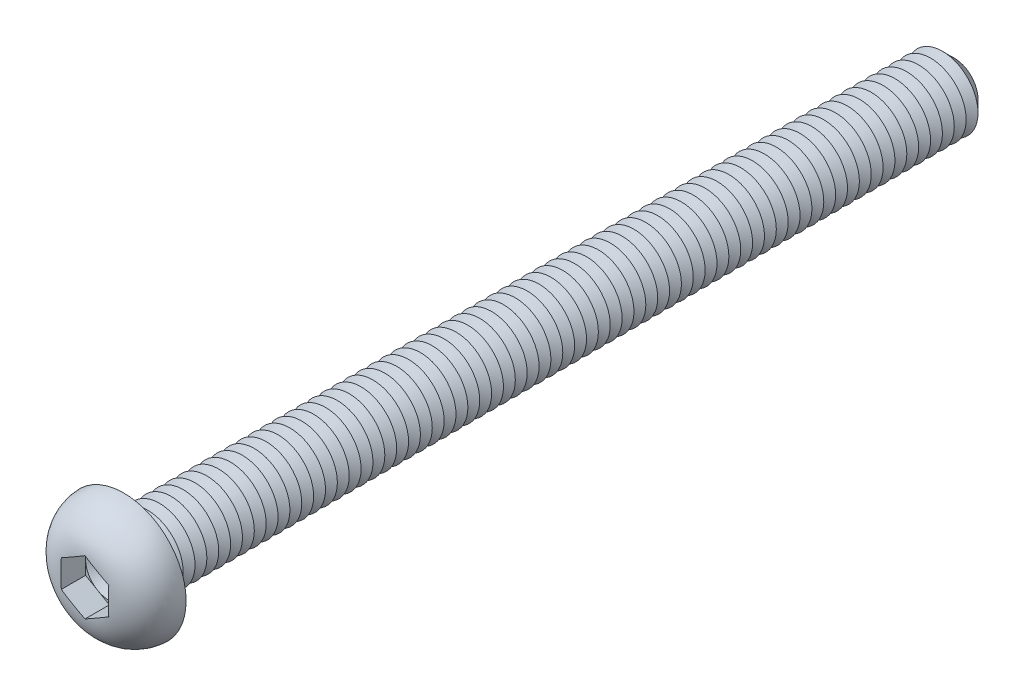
SolidWorks part; units mm, degrees
ref_plane "Front Plane" through (0, 0, 0) normal (0, 0, 1) x (1, 0, 0)
ref_plane "Top Plane" through (0, 0, 0) normal (0, 1, 0) x (1, 0, 0)
ref_plane "Right Plane" through (0, 0, 0) normal (1, 0, 0) x (0, 0, -1)
sketch "Sketch1" plane through (0, 0, 0) normal (1, 0, 0) x (0, 0, -1)
  line L0 (-47.9342, 0) -> (60.3146, 0) construction
sketch "Sketch2" plane through (0, 0, 0) normal (1, 0, 0) x (0, 0, -1)
  line L0 (0, 0) -> (-3.3, 0)
  line L1 (-47.9342, 0) -> (60.3146, 0) construction
  line L2 (-3.3, 0) -> (-3.3, 1.8515)
  line L3 (0, 5.25) -> (0, 0)
  arc A0 (-3.3, 1.8515) -> (0, 5.25) centre (0.1, 1.8515) cw
  dimension "D1" = 3.4
  dimension "D2" = 3.3
  dimension "D3" = 5.25
revolve "Revolve1" add sketch "Sketch2" angle 360 about L0
sketch "Sketch3" plane through (0, 0, 3.3) normal (0, 0, 1) x (1, 0, 0)
  line L1 (0, 2.3094) -> (-2, 1.1547)
  line L2 (-2, 1.1547) -> (-2, -1.1547)
  line L3 (-2, -1.1547) -> (0, -2.3094)
  line L4 (0, -2.3094) -> (2, -1.1547)
  line L5 (2, -1.1547) -> (2, 1.1547)
  line L6 (2, 1.1547) -> (0, 2.3094)
  circle A0 centre (0, 0) radius 2 construction
  dimension "D1" = 4
extrude "Cut-Extrude1" cut sketch "Sketch3" against normal blind 2.08
sketch "Sketch4" plane through (0, 0, 0) normal (0, 0, -1) x (-1, 0, 0)
  circle A0 centre (0, 0) radius 3
  dimension "D1" = 6
extrude "Boss-Extrude1" add sketch "Sketch4" along normal blind 70
chamfer "Chamfer1" distance 1 angle 45 1 edges at (-3, 0, -70)
sketch "Sketch5" plane through (0, 0, 0) normal (1, 0, 0) x (0, 0, -1)
  line L0 (1, 3) -> (2, 3)
  line L1 (69, 3) -> (0, 3) construction
  line L2 (2, 3) -> (1.5, 2.134)
  line L3 (1.5, 2.134) -> (1, 3)
  line L4 (0, -5.25) -> (0, 5.25) construction
  line L5 (69, 3) -> (0, 3) construction
  dimension "D1" = 1
  dimension "D2" = 1
revolve "Cut-Revolve1" cut sketch "Sketch5" angle 360 about L0
pattern_linear "LPattern1" count 68 spacing 1 along (0, 0, -1) of "Cut-Revolve1"
fillet "Fillet2" radius 0.4 1 edges at (-3, 0, 0)
sketch "Sketch6" plane through (0, 0, 1.22) normal (0, 0, 1) x (1, 0, 0)
  line L0 (0, -2.3094) -> (2, -1.1547) construction
  circle A0 centre (0, 0) radius 2
extrude "Cut-Extrude2" cut sketch "Sketch6" against normal through all draft 60
